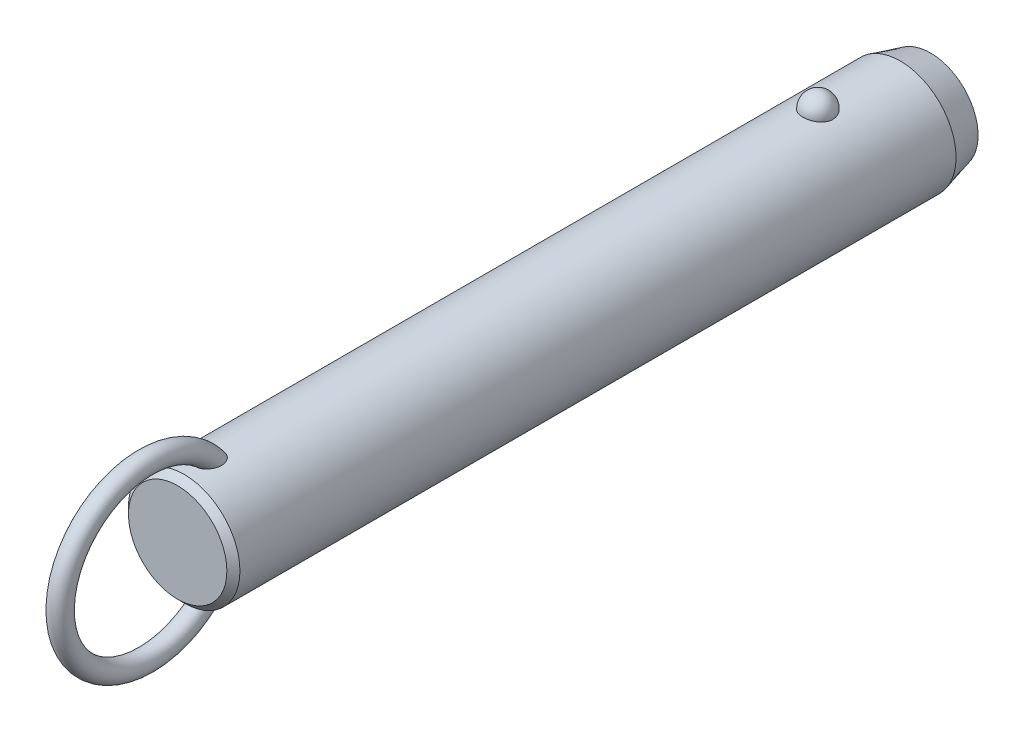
SolidWorks part; units mm, degrees
ref_plane "Front Plane" through (0, 0, 0) normal (0, 0, 1) x (1, 0, 0)
ref_plane "Top Plane" through (0, 0, 0) normal (0, 1, 0) x (1, 0, 0)
ref_plane "Right Plane" through (0, 0, 0) normal (1, 0, 0) x (0, 0, -1)
sketch "Sketch2" plane through (0, 0, 0) normal (0, 0, 1) x (1, 0, 0)
  circle A0 centre (0, 0) radius 11.1
  point P3 (0, 11.1)
  dimension "D1" = 22.2
extrude "Boss-Extrude1" add sketch "Sketch2" along normal blind 111.8
sketch "Sketch3" plane through (0, 0, 0) normal (0, 0, -1) x (-1, 0, 0)
  circle A0 centre (0, 0) radius 11.1
  dimension "D1" = 22.2
extrude "Boss-Extrude2" add sketch "Sketch3" along normal blind 25.4
chamfer "Chamfer1" distance 6 angle 15 1 edges at (-11.1, 0, -25.4)
sketch "Sketch12" plane through (0, 0, 0) normal (1, 0, 0) x (0, 0, -1)
  line L0 (-111.8, 11.1) -> (-111.8, -11.1) construction
  point P0 (-111.8, 0)
sketch "Sketch13" plane through (0, 0, 0) normal (1, 0, 0) x (0, 0, -1)
  circle A0 centre (-130.85, 0) radius 19.05
  point P2 (-111.8, 0)
  dimension "D1" = 38.1
sketch "Sketch14" plane through (0, 0, 0) normal (0, 1, 0) x (1, 0, 0)
  circle A0 centre (0, -113.8) radius 2
  point P2 (0, -111.8)
  dimension "D1" = 4
sweep "Sweep1" add profiles "Sketch14" path "Sketch13"
sketch "Sketch15" plane through (0, 0, 111.8) normal (0, 0, 1) x (1, 0, 0)
  circle A0 centre (0, 0) radius 11.1
  dimension "D1" = 22.2
extrude "Boss-Extrude3" add sketch "Sketch15" along normal blind 12.7
chamfer "Chamfer2" distance 1.3 angle 45 1 edges at (11.1, 0, 124.5)
sketch "Sketch18" plane through (0, 0, 0) normal (1, 0, 0) x (0, 0, -1)
  line L0 (19.4, 11.1) -> (-115.368, 11.1) construction
  line L1 (3, 14.1) -> (3, 8.1)
  line L2 (-115.368, -11.1) -> (19.4, -11.1) construction
  arc A0 (3, 14.1) -> (3, 8.1) centre (3, 11.1) ccw
  point P4 (0, 11.1)
  dimension "D1" = 25.2
revolve "Revolve1" add sketch "Sketch18" angle 360 about L1
